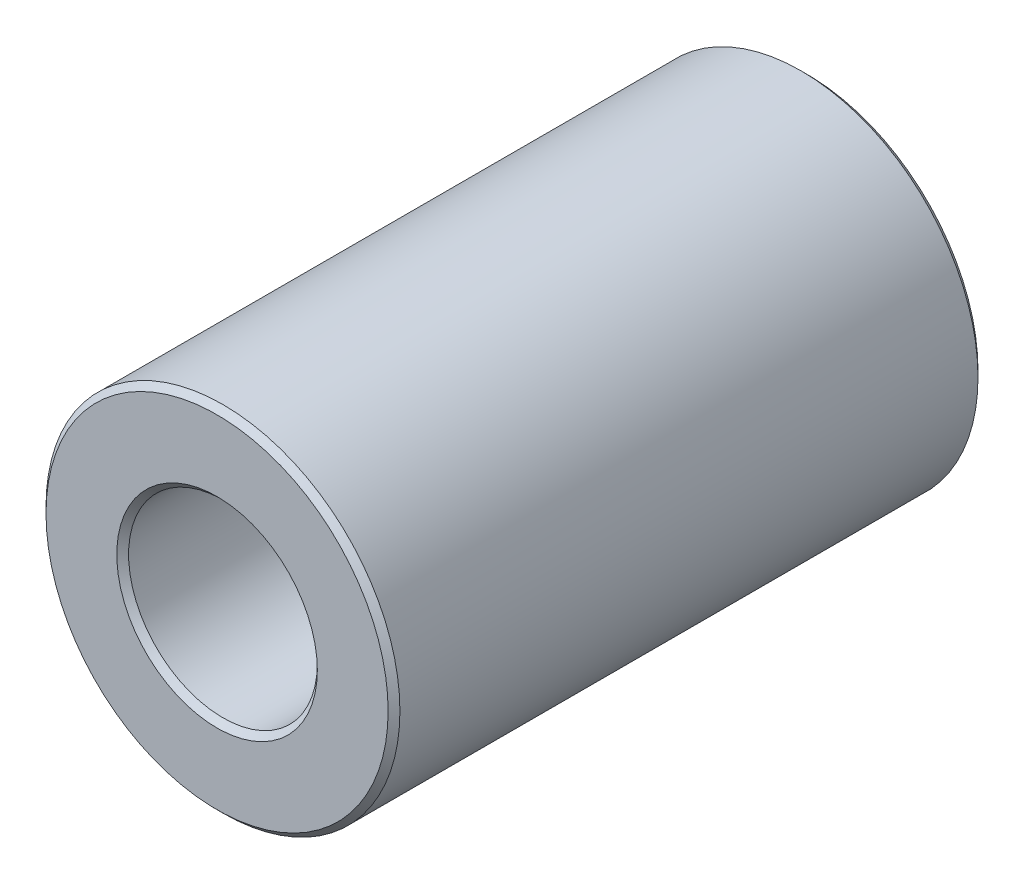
SolidWorks part; units mm, degrees
ref_plane "Front Plane" through (0, 0, 0) normal (0, 0, 1) x (1, 0, 0)
ref_plane "Top Plane" through (0, 0, 0) normal (0, 1, 0) x (1, 0, 0)
ref_plane "Right Plane" through (0, 0, 0) normal (1, 0, 0) x (0, 0, -1)
sketch "Sketch1" plane through (0, 0, 0) normal (0, 0, 1) x (1, 0, 0)
  circle A0 centre (0, 0) radius 3
  circle A1 centre (0, 0) radius 1.6
  dimension "D1" = 6
  dimension "D2" = 3.2
extrude "Boss-Extrude2" add sketch "Sketch1" along normal mid plane 10
chamfer "Chamfer3" distance 0.1 angle 45 4 edges at (3, 0, 5) (3, 0, -5) (1.6, 0, -5) (1.6, 0, 5)
